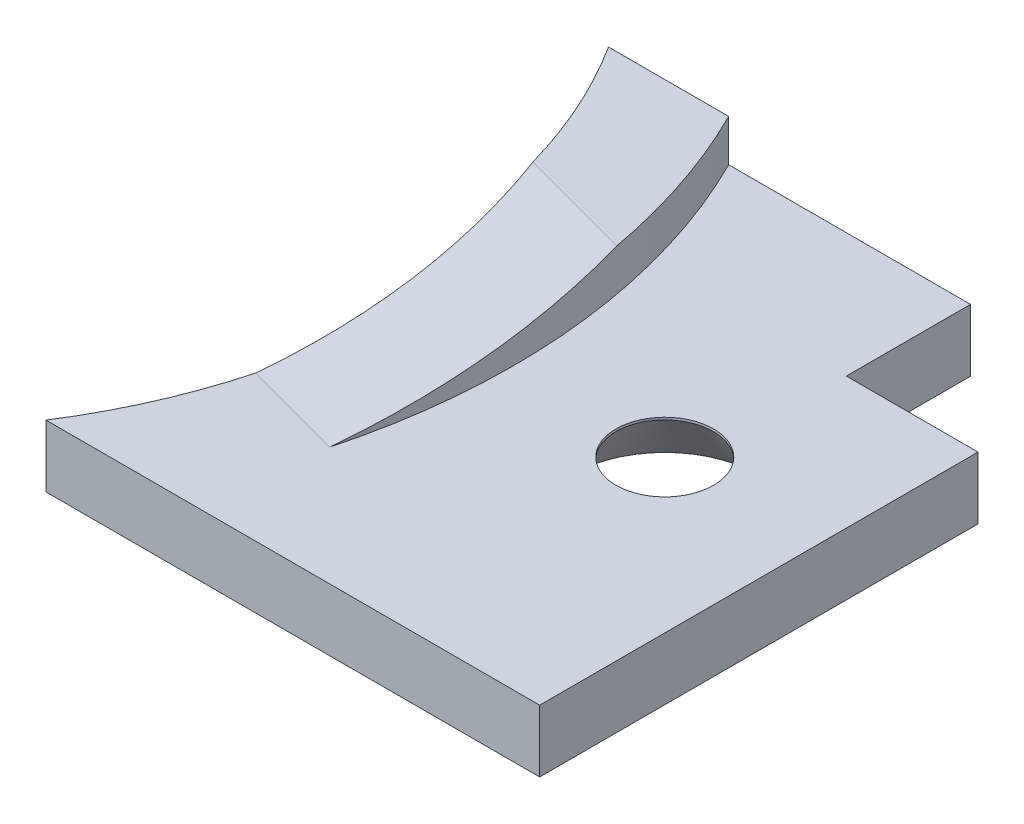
SolidWorks part; units mm, degrees
ref_plane "Front Plane" through (0, 0, 0) normal (0, 0, 1) x (1, 0, 0)
ref_plane "Top Plane" through (0, 0, 0) normal (0, 1, 0) x (1, 0, 0)
ref_plane "Right Plane" through (0, 0, 0) normal (1, 0, 0) x (0, 0, -1)
sketch "Sketch1" plane through (0, 0, 0) normal (0, 1, 0) x (1, 0, 0)
  line L0 (-4.4, 18.8) -> (-4.4, 14.65)
  line L1 (-16.5, 18.8) -> (0, 18.8)
  line L3 (-16.5, 0) -> (0, 0)
  line L4 (0, 18.8) -> (0, 0)
  line L5 (-4.4, 14.65) -> (0, 14.65)
  circle A0 centre (-5.09, 9.271) radius 1.632
  arc A10 (-16.5, 0) -> (-16.5, 18.8) centre (-31.2611, 9.4) ccw
  dimension "D11" = 17.5
  dimension "D2" = 3.264
  dimension "D1" = 18.8
  dimension "D3" = 16.5
  dimension "D7" = 4.4
  dimension "D8" = 4.15
  dimension "D10" = 5.09
  dimension "D13" = 9.271
  dimension "D14" = 9.529
extrude "Boss-Extrude1" add sketch "Sketch1" along normal blind 2.08 contours A10 L3 L4 L5 L0 L1 A0
sketch "Sketch2" plane through (0, 2.08, 0) normal (0, 1, 0) x (1, 0, 0)
  line L0 (-16.5, 18.8) -> (-12.4824, 18.8)
  line L1 (-16.5, 18.8) -> (-4.4, 18.8) construction
  line L2 (-31.2611, 9.4) -> (-10.9767, 3.9648)
  line L3 (-16.5, 0) -> (-12.4824, 0)
  line L4 (-31.2611, 9.4) -> (-10.2611, 9.4) construction
  arc A0 (-12.4824, 0) -> (-12.4824, 18.8) centre (-31.2611, 9.4) ccw
  arc A1 (-16.5, 0) -> (-16.5, 18.8) centre (-31.2611, 9.4) ccw construction
  arc A2 (-16.5, 0) -> (-16.5, 18.8) centre (-31.2611, 9.4) ccw
  dimension "D1" = 3.5
  dimension "D2" = 15
extrude "Boss-Extrude2" add sketch "Sketch2" along normal blind 1.4 contours L2 A0 M8 M3 | L4 A2 L2 A0
chamfer "Chamfer1" distance 1.4 distance2 9 1 edges at (-12.667, 3.48, -4.4177)
chamfer "Chamfer2" distance 2 distance2 1.5 1 edges at (-5.09, 0, -7.639)
